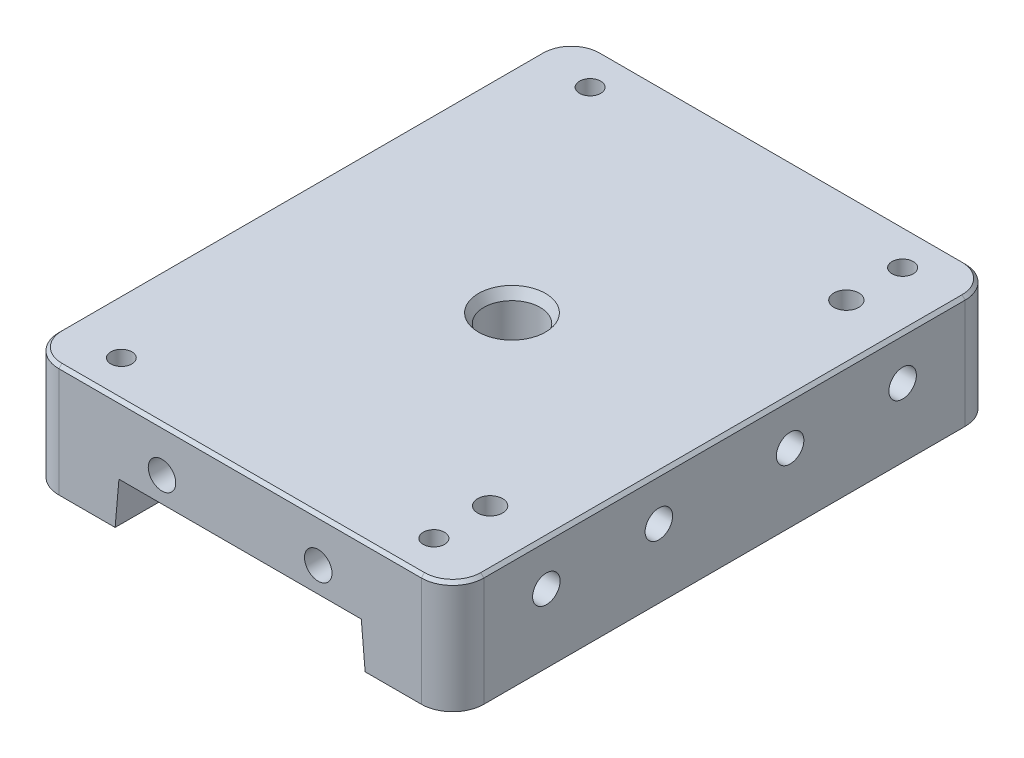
SolidWorks part; units mm, degrees
ref_plane "Plan de face" through (0, 0, 0) normal (0, 0, 1) x (1, 0, 0)
ref_plane "Plan de dessus" through (0, 0, 0) normal (0, 1, 0) x (1, 0, 0)
ref_plane "Plan de droite" through (0, 0, 0) normal (1, 0, 0) x (0, 0, -1)
imported_body "Importée1"
fillet "Congé2" radius 0.5
fillet "Congé6" radius 0.5 4 edges at (15.2051, 2.2838, 45.1675)
fillet "Congé3" radius 0.5 12 edges
fillet "Congé4" radius 0.5 12 edges
fillet "Congé5" radius 0.5 85 edges at (-15.194, 3.5525, 9.6513) (-15.1889, 4.1408, 14.6728) (-15.1719, 6.09, 15.2781) (-15.1548, 8.0392, 15.8835) (-15.1497, 8.6275, 19.285) (-15.1548, 8.0392, 22.6865) (-12.2553, 8.6275, 19.285) (-12.2502, 8.0392, 22.6865) (-15.1721, 6.0637, 23.2921) (-12.2502, 8.0392, 15.8835) (-12.2329, 6.0637, 23.2921) (-12.2331, 6.09, 15.2781) (-12.2161, 4.1408, 14.6728) (-12.211, 3.5525, 9.6513) (-15.2161, 1.0194, 50.2336) (-15.201, 2.7508, 49.9243) (-15.2161, 1.015, 12.1745) (-15.2206, 0.5075, 18.269) (-18.2628, 1.015, 12.1745) (-21.3123, 0.5075, 6.0856) (-18.2628, 1.015, 6.0811) (-15.2051, 2.2838, 6.0701) (-13.7025, 3.5525, 6.059) (-12.2154, 4.06, 6.0546) (-12.2199, 4.5675, 3.0251) (-18.2628, 1.015, 123.9189) (-21.3123, 0.5075, 123.9144) (-18.2628, 1.015, 117.8255) (-15.2206, 0.5075, 111.731) (-15.2161, 1.015, 117.8255) (-15.2051, 2.2838, 123.9299) (-13.7025, 3.5525, 123.941) (-12.2154, 4.06, 123.9454) (-12.2199, 4.5675, 126.9749)
fillet "Congé7" radius 0.5 14 edges at (-15.2051, 2.2837, 45.1675)
